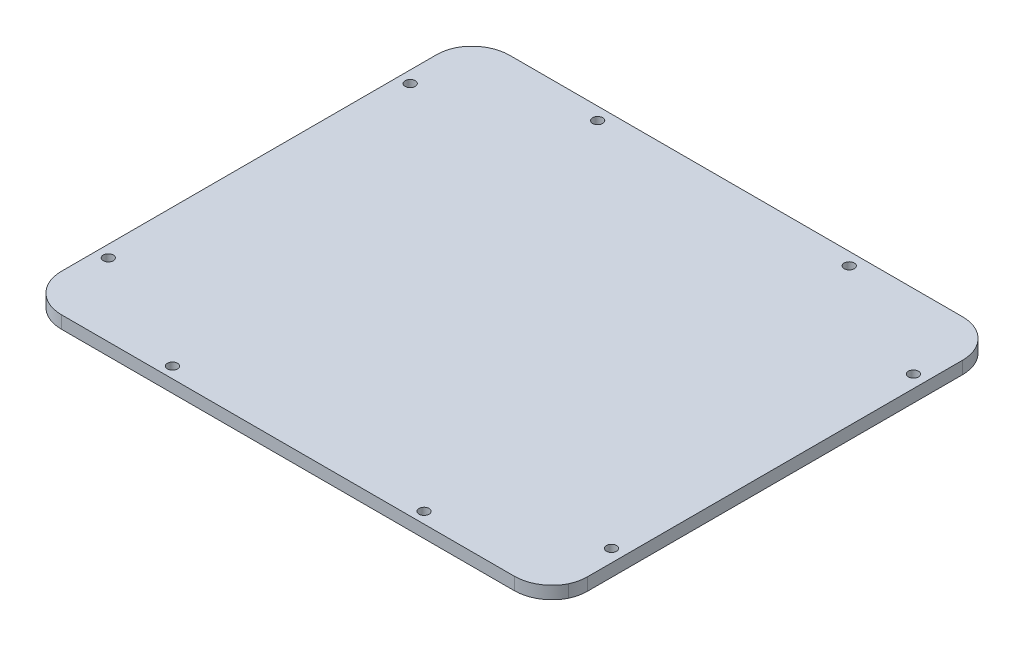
SolidWorks part; units mm, degrees
ref_plane "Front Plane" through (0, 0, 0) normal (0, 0, 1) x (1, 0, 0)
ref_plane "Top Plane" through (0, 0, 0) normal (0, 1, 0) x (1, 0, 0)
ref_plane "Right Plane" through (0, 0, 0) normal (1, 0, 0) x (0, 0, -1)
sketch "Sketch1" plane through (0, 0, 0) normal (0, 1, 0) x (1, 0, 0)
  line L0 (-0.298, 88.8911) -> (-0.298, -90.1089) construction
  line L1 (0, 141.1835) -> (0, -146.7285) construction
  line L2 (-152.1784, 0) -> (163.3837, 0) construction
  line L3 (-105.298, -0.6089) -> (104.702, -0.6089) construction
  line L4 (-90, -89.5) -> (90, -89.5)
  line L5 (-105, -74.5) -> (-105, 74.5)
  line L6 (-90, 89.5) -> (90, 89.5)
  line L7 (105, -74.5) -> (105, 74.5)
  line L8 (-105, -89.5) -> (105, 89.5) construction
  line L9 (-105, 89.5) -> (105, -89.5) construction
  line L10 (-90.298, -90.1089) -> (89.702, -90.1089)
  line L11 (104.702, -75.1089) -> (104.702, 73.8911)
  line L12 (89.702, 88.8911) -> (-90.298, 88.8911)
  line L13 (-105.298, 73.8911) -> (-105.298, -75.1089)
  arc A8 (-105, -74.5) -> (-90, -89.5) centre (-90, -74.5) ccw
  arc A9 (90, -89.5) -> (105, -74.5) centre (90, -74.5) ccw
  arc A10 (105, 74.5) -> (90, 89.5) centre (90, 74.5) ccw
  arc A11 (-105, 74.5) -> (-90, 89.5) centre (-90, 74.5) cw
  arc A12 (89.702, -90.1089) -> (104.702, -75.1089) centre (89.702, -75.1089) ccw
  arc A13 (104.702, 73.8911) -> (89.702, 88.8911) centre (89.702, 73.8911) ccw
  arc A14 (-90.298, 88.8911) -> (-105.298, 73.8911) centre (-90.298, 73.8911) ccw
  arc A15 (-105.298, -75.1089) -> (-90.298, -90.1089) centre (-90.298, -75.1089) ccw
  circle A16 centre (-50.298, 83.8911) radius 2
  circle A17 centre (49.702, 83.8911) radius 2
  circle A18 centre (99.702, 59.3911) radius 2
  circle A19 centre (99.702, -60.6089) radius 2
  circle A20 centre (49.702, -85.1089) radius 2
  circle A21 centre (-50.298, -85.1089) radius 2
  circle A22 centre (-100.298, -60.6089) radius 2
  circle A23 centre (-100.298, 59.3911) radius 2
  point P0 (0, 0)
  point P6 (0, 0)
  point P7 (0, 0)
  point P24 (0, 0)
  point P41 (0, 0)
  point P43 (0, 0)
  dimension "D5" = 15
  dimension "D3" = 179
  dimension "D4" = 210
extrude "Boss-Extrude1" add sketch "Sketch1" along normal blind 5 contours L12 A14 A11 L5 A8 L4 A9 A12 L11 A13 A23 A22 A21 A20 A19 A18 A17 A16
